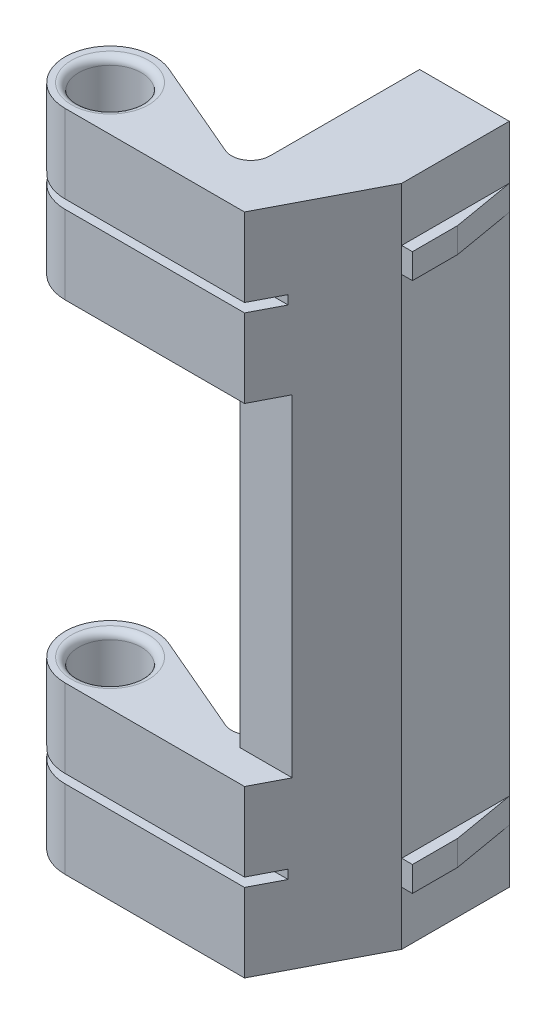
SolidWorks part; units mm, degrees
ref_plane "前视" through (0, 0, 0) normal (0, 0, 1) x (1, 0, 0)
ref_plane "上视" through (0, 0, 0) normal (0, 1, 0) x (1, 0, 0)
ref_plane "右视" through (0, 0, 0) normal (1, 0, 0) x (0, 0, -1)
sketch "草图1" plane through (0, 0, 0) normal (0, 1, 0) x (1, 0, 0)
  line L2 (-4, 23.5326) -> (6, 23.5326)
  line L3 (6, 23.5326) -> (6, 11.5326)
  line L4 (6, 11.5326) -> (0, 0)
  line L5 (0, 0) -> (-20, 0)
  line L7 (-18.0319, 9.5964) -> (-7.0006, 4.8731)
  line L8 (-4, 6.8524) -> (-4, 23.5326)
  arc A0 (-18.0319, 9.5964) -> (-20, 0) centre (-20, 5) ccw
  arc A1 (-4, 6.8524) -> (-7.0006, 4.8731) centre (-6.1531, 6.8524) cw
  dimension "D2" = 5
  dimension "D1" = 10
  dimension "D3" = 12
  dimension "D4" = 20
  dimension "D5" = 13
  dimension "D6" = 152.514
  dimension "D7" = 12
  dimension "D8" = 16.6802
extrude "拉伸1" add sketch "草图1" along normal blind 74
sketch "草图2" plane through (0, 0, 0) normal (0, 0, 1) x (1, 0, 0)
  line L0 (4, 37) -> (-49996, 37) construction
  line L1 (0, 74) -> (0, 0) construction
  line L2 (-10, 0) -> (-10, 50000) construction
  line L3 (-20, 0) -> (0, 0) construction
  line L5 (-45.8029, 55.5) -> (21.1534, 55.5)
  line L6 (-45.8029, 55.5) -> (-45.8029, 18.5)
  line L7 (-45.8029, 18.5) -> (21.1534, 18.5)
  line L8 (21.1534, 55.5) -> (21.1534, 18.5)
  point P4 (0, 37)
  point P9 (-10, 0)
  dimension "D1" = 37
extrude "切除-拉伸1" cut sketch "草图2" against normal blind 3.5
sketch "草图3" plane through (0, 0, -3.5) normal (0, 0, 1) x (1, 0, 0)
  line L0 (-21.2316, 37) -> (49978.7684, 37) construction
  line L1 (-24.7697, 55.5) -> (-24.7697, 18.5) construction
  line L2 (6, 74) -> (6, 0) construction
  line L3 (-40.1785, 55.5) -> (-4, 55.5)
  line L4 (-40.1785, 55.5) -> (-40.1785, 18.5)
  line L5 (-40.1785, 18.5) -> (-4, 18.5)
  line L6 (-4, 55.5) -> (-4, 18.5)
  point P4 (-24.7697, 37)
  dimension "D1" = 37
  dimension "D2" = 10
extrude "切除-拉伸2" cut sketch "草图3" against normal blind 10
sketch "草图7" plane through (-4, 0, 0) normal (-1, 0, 0) x (0, 0, 1)
  line L0 (1.0326, 37) -> (-49998.9674, 37) construction
  line L1 (-3.5, 18.5) -> (-3.5, 55.5) construction
  line L2 (-23.5326, 74) -> (-23.5326, 0) construction
  line L3 (-23.5326, 48.0876) -> (-15.5326, 48.0876)
  line L4 (-23.5326, 48.0876) -> (-23.5326, 25.9124)
  line L5 (-23.5326, 25.9124) -> (-15.5326, 25.9124)
  line L6 (-15.5326, 48.0876) -> (-15.5326, 25.9124)
  point P4 (-3.5, 37)
  dimension "D1" = 8
extrude "拉伸2" add sketch "草图7" along normal blind 2.5
sketch "草图8" plane through (0, 25.9124, 0) normal (0, -1, 0) x (1, 0, 0)
  line L0 (-6.5, -23.5326) -> (-4, -15.5326)
  line L1 (-4, -15.5326) -> (-6.5, -15.5326)
  line L2 (-6.5, -15.5326) -> (-6.5, -23.5326)
extrude "切除-拉伸3" cut sketch "草图8" against normal blind 30
sketch "草图9" plane through (0, 74, 0) normal (0, 1, 0) x (1, 0, 0)
  circle A0 centre (-20, 5) radius 3.5
  arc A1 (-18.0319, 9.5964) -> (-20, 0) centre (-20, 5) ccw construction
  dimension "D1" = 7
extrude "切除-拉伸4" cut sketch "草图9" against normal through all
sketch "草图10" plane through (6, 0, 0) normal (1, 0, 0) x (0, 0, -1)
  line L0 (11.5326, 74) -> (11.5326, 0) construction
  line L1 (11.5326, 68) -> (23.5326, 68)
  line L2 (11.5326, 68) -> (11.5326, 65.2)
  line L3 (11.5326, 65.2) -> (23.5326, 65.2)
  line L4 (23.5326, 68) -> (23.5326, 65.2)
  line L5 (23.5326, 74) -> (23.5326, 0) construction
  line L6 (11.5326, 74) -> (23.5326, 74) construction
  line L7 (19, 37) -> (-49981, 37) construction
  line L8 (23.5326, 6) -> (23.5326, 8.8)
  line L9 (11.5326, 8.8) -> (23.5326, 8.8)
  line L10 (11.5326, 6) -> (11.5326, 8.8)
  line L11 (11.5326, 6) -> (23.5326, 6)
  point P12 (23.5326, 37)
  dimension "D1" = 2.8
  dimension "D2" = 6
extrude "拉伸3" add sketch "草图10" along normal blind 1.2
sketch "草图11" plane through (0, 6, 0) normal (0, -1, 0) x (1, 0, 0)
  line L0 (6, -23.5326) -> (7.2, -16.5722)
  line L1 (7.2, -11.5326) -> (7.2, -23.5326) construction
  line L2 (7.2, -16.5722) -> (7.2, -23.5326)
  line L3 (7.2, -23.5326) -> (6, -23.5326)
extrude "切除-拉伸5" cut sketch "草图11" against normal through all
sketch "草图12" plane through (0, 0, -23.5326) normal (0, 0, -1) x (-1, 0, 0)
  line L0 (2.5, 37) -> (-49997.5, 37) construction
  line L1 (6.5, 48.0876) -> (6.5, 25.9124) construction
  line L2 (-1, 0) -> (-1, 50000) construction
  line L3 (-6, 0) -> (4, 0) construction
  circle A0 centre (-1, 37) radius 3
  circle A1 centre (-1, 62) radius 3
  circle A2 centre (-1, 12) radius 3
  point P4 (6.5, 37)
  point P9 (-1, 0)
  dimension "D1" = 6
  dimension "D2" = 6
  dimension "D3" = 6
  dimension "D4" = 25
  dimension "D5" = 25
extrude "切除-拉伸6" cut sketch "草图12" against normal blind 12
sketch "草图13" plane through (0, 0, -23.5326) normal (0, 0, -1) x (-1, 0, 0)
  line L0 (-10, 37) -> (49990, 37) construction
  line L1 (-6, 65.2) -> (-6, 8.8) construction
  line L2 (-1, 1066.5) -> (-1, 66.5) construction
  line L3 (-6, 74) -> (4, 74) construction
  line L4 (-6, 74) -> (-6, 68) construction
  line L5 (-5, 73) -> (3, 73)
  line L6 (-5, 73) -> (-5, 64.0616)
  line L7 (-5, 1) -> (3, 1)
  line L8 (3, 73) -> (3, 64.0616)
  line L9 (-6, 0) -> (4, 0) construction
  line L10 (3, 9.9384) -> (3, 1)
  line L11 (-1, 7.5) -> (-1, -49926) construction
  line L12 (-5, 9.9384) -> (-5, 1)
  line L13 (3, 33.6774) -> (3, 14.0616)
  line L14 (-1, 31.8) -> (-1, 16.5) construction
  line L15 (-5, 33.6774) -> (-5, 14.0616)
  line L16 (-5, 59.9384) -> (-5, 40.3226)
  line L17 (-1, 57.5) -> (-1, 42.2) construction
  line L18 (3, 59.9384) -> (3, 40.3226)
  arc A0 (-5, 33.6774) -> (3, 33.6774) centre (-1, 37) ccw
  arc A1 (3, 64.0616) -> (-5, 64.0616) centre (-1, 62) ccw
  arc A2 (-5, 59.9384) -> (3, 59.9384) centre (-1, 62) ccw
  arc A3 (3, 40.3226) -> (-5, 40.3226) centre (-1, 37) ccw
  arc A4 (3, 14.0616) -> (-5, 14.0616) centre (-1, 12) ccw
  circle A5 centre (-1, 62) radius 3 construction
  circle A6 centre (-1, 37) radius 3 construction
  circle A8 centre (-1, 12) radius 3 construction
  arc A9 (-5, 9.9384) -> (3, 9.9384) centre (-1, 12) ccw
  point P4 (-6, 37)
  point P9 (-1, 74)
  dimension "D4" = 1.5
  dimension "D5" = 2.2
  dimension "D6" = 1.5
  dimension "D1" = 1
  dimension "D2" = 1
  dimension "D3" = 1
extrude "切除-拉伸7" cut sketch "草图13" against normal blind 12
fillet "圆角1" radius 1 3 edges at (-2, 12, -23.5326) (-2, 37, -23.5326) (-2, 62, -23.5326)
fillet "圆角2" radius 0.8 4 edges at (-20, 0, -1.5) (-23.5, 55.5, -5) (-16.5, 18.5, -5) (-20, 74, -1.5)
sketch "草图14" plane through (0, 0, 0) normal (0, 0, 1) x (1, 0, 0)
  line L0 (10, 37) -> (-49990, 37) construction
  line L1 (6, 65.2) -> (6, 8.8) construction
  line L2 (8.5094, 8.75) -> (8.5094, 9.75)
  line L4 (-27.3256, 9.75) -> (8.5094, 9.75)
  line L5 (-27.3256, 65.25) -> (8.5094, 65.25)
  line L6 (-27.3256, 65.25) -> (-27.3256, 64.25)
  line L7 (-27.3256, 64.25) -> (8.5094, 64.25)
  line L8 (8.5094, 65.25) -> (8.5094, 64.25)
  line L9 (-27.3256, 8.75) -> (-27.3256, 9.75)
  line L10 (-27.3256, 8.75) -> (8.5094, 8.75)
  point P4 (6, 37)
  dimension "D1" = 1
extrude "切除-拉伸8" cut sketch "草图14" against normal blind 3.2
